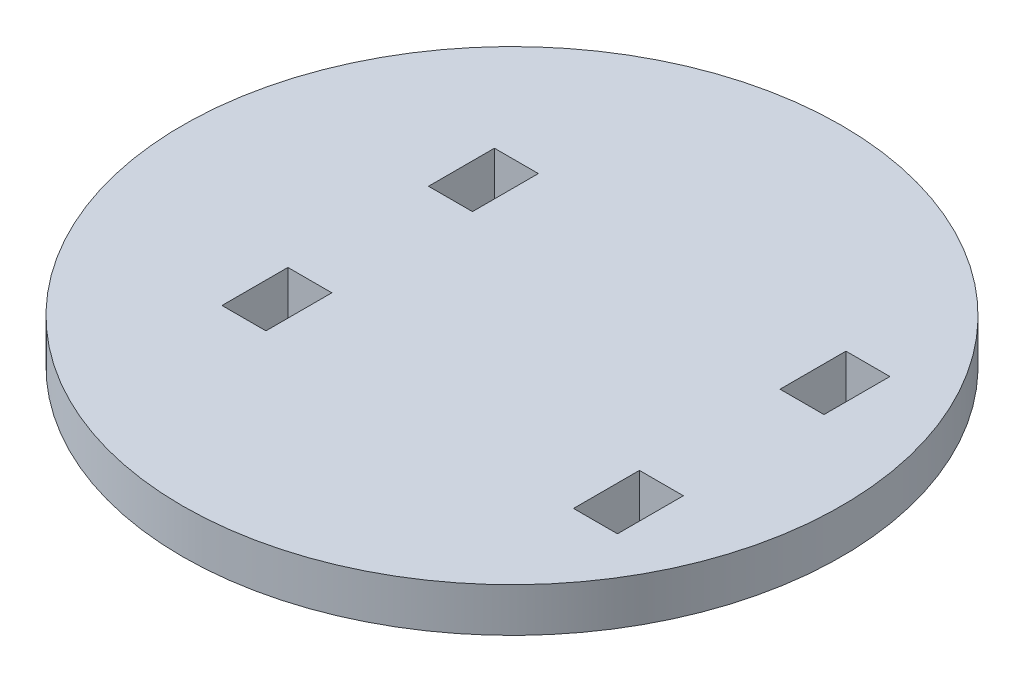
SolidWorks part; units mm, degrees
ref_plane "Front Plane" through (0, 0, 0) normal (0, 0, 1) x (1, 0, 0)
ref_plane "Top Plane" through (0, 0, 0) normal (0, 1, 0) x (1, 0, 0)
ref_plane "Right Plane" through (0, 0, 0) normal (1, 0, 0) x (0, 0, -1)
sketch "Sketch2" plane through (0, 0, 0) normal (0, 1, 0) x (1, 0, 0)
  circle A0 centre (0, 0) radius 37.5
  dimension "D1" = 75
extrude "Boss-Extrude1" add sketch "Sketch2" along normal blind 5 contours A0
sketch "Sketch3" plane through (0, 0, 0) normal (0, -1, 0) x (1, 0, 0)
  circle A0 centre (0, 11) radius 0.5
  circle A1 centre (0, 15) radius 0.5
  circle A2 centre (0, 0) radius 0.5
  dimension "D1" = 1
  dimension "D2" = 1
  dimension "D5" = 1
  dimension "D3" = 11
  dimension "D4" = 4
extrude "Cut-Extrude1" cut sketch "Sketch3" against normal blind 1 contours A1 | A0 | A2
sketch "Sketch4" plane through (0, 5, 0) normal (0, 1, 0) x (1, 0, 0)
  line L0 (-17.5, 15.5) -> (-17.5, 8)
  line L1 (-17.5, 8) -> (-12.5, 8)
  line L2 (-12.5, 8) -> (-12.5, 15.5)
  line L3 (-17.5, 15.5) -> (-12.5, 15.5)
  line L4 (22.5, 15.5) -> (22.5, 8)
  line L5 (22.5, 8) -> (27.5, 8)
  line L6 (27.5, 8) -> (27.5, 15.5)
  line L7 (27.5, 15.5) -> (22.5, 15.5)
  line L8 (-17.5, -8) -> (-17.5, -15.5)
  line L9 (-17.5, -15.5) -> (-12.5, -15.5)
  line L10 (-12.5, -15.5) -> (-12.5, -8)
  line L11 (-12.5, -8) -> (-17.5, -8)
  line L12 (22.5, -8) -> (22.5, -15.5)
  line L13 (22.5, -15.5) -> (27.5, -15.5)
  line L14 (27.5, -15.5) -> (27.5, -8)
  line L15 (27.5, -8) -> (22.5, -8)
  dimension "D1" = 22.5
  dimension "D2" = 12.5
  dimension "D3" = 15.5
  dimension "D4" = 15.5
  dimension "D5" = 15.5
  dimension "D6" = 15.5
  dimension "D7" = 5
  dimension "D8" = 7.5
  dimension "D9" = 7.5
  dimension "D10" = 7.5
  dimension "D11" = 7.5
  dimension "D12" = 5
extrude "Cut-Extrude2" cut sketch "Sketch4" against normal blind 10 contours L3 L2 L1 L0 | L11 L8 L9 L10 | L7 L4 L5 L6 | L15 L12 L13 L14
